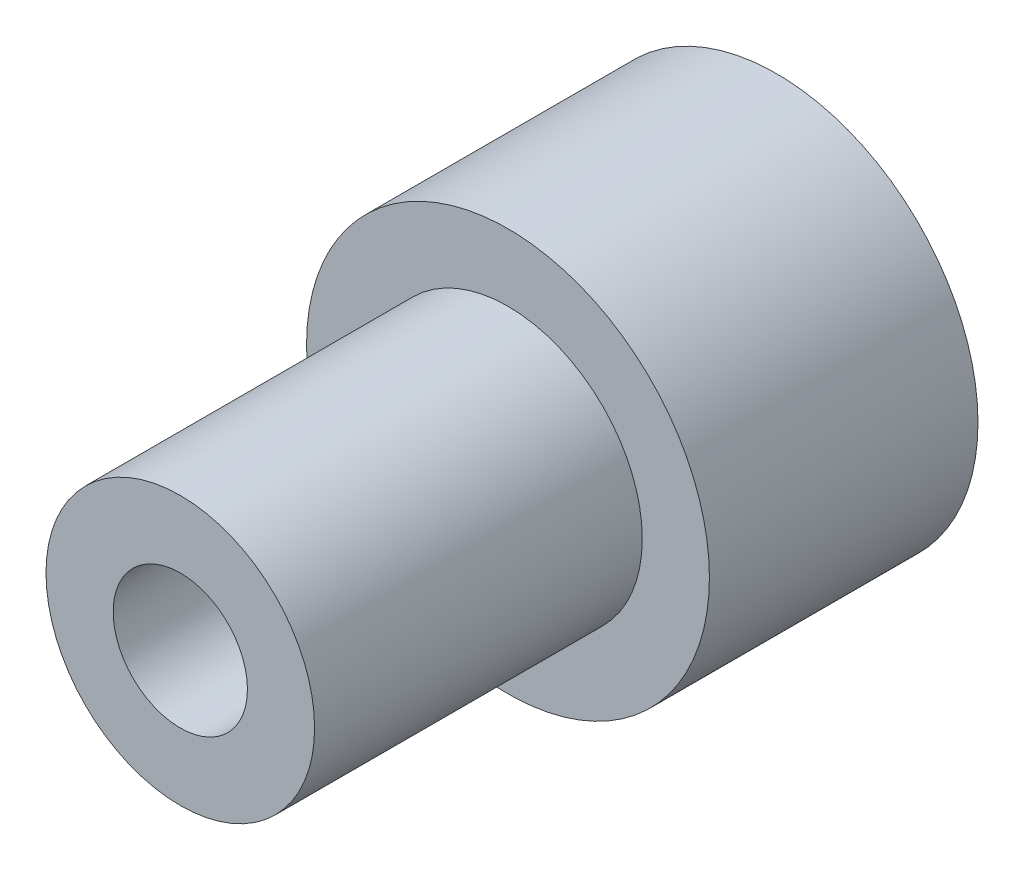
SolidWorks part; units mm, degrees
extrude "Base-Extrude" add sketch "Sketch1" along normal blind 6.35
sketch "Sketch1" plane through (0, 0, 0) normal (0, 0, 1) x (1, 0, 0)
  circle A0 centre (0, 0) radius 4.7625
  dimension "D1" = 9.525
extrude "Boss-Extrude1" add sketch "Sketch2" along normal blind 7.747
sketch "Sketch2" plane through (0, 0, 6.35) normal (0, 0, 1) x (1, 0, 0)
  circle A0 centre (0, 0) radius 3.175
  dimension "D1" = 6.35
extrude "Cut-Extrude1" cut sketch "Sketch3" against normal through all
sketch "Sketch3" plane through (0, 0, 14.097) normal (0, 0, 1) x (1, 0, 0)
  circle A0 centre (0, 0) radius 1.5875
  dimension "D1" = 3.175
ref_plane "Plane1" through (0, 0, 0) normal (0, 0, 1) x (1, 0, 0)
ref_plane "Plane2" through (0, 0, 0) normal (0, 1, 0) x (1, 0, 0)
ref_plane "Plane3" through (0, 0, 0) normal (1, 0, 0) x (0, 0, -1)
sketch "Sketch4" plane through (0, 0, 0) normal (0, 0, -1) x (-1, 0, 0)
  line L0 (0, 3.9566) -> (0, -3.9566) construction
  line L1 (2.3812, 1.3748) -> (2.3813, -1.3748)
  line L2 (0, 0) -> (2.3813, 0) construction
  line L3 (0, 0) -> (2.3812, 1.3748) construction
  line L4 (2.3812, 1.3748) -> (0, 2.7496)
  line L5 (-2.3812, 1.3748) -> (-2.3812, -1.3748)
  line L6 (-2.3812, 1.3748) -> (0, 2.7496)
  line L7 (0, -2.7496) -> (2.3813, -1.3748)
  line L8 (-2.3812, -1.3748) -> (0, -2.7496)
  dimension "D3" = 4.7625
extrude "Cut-Extrude2" cut sketch "Sketch4" against normal blind 3.683
